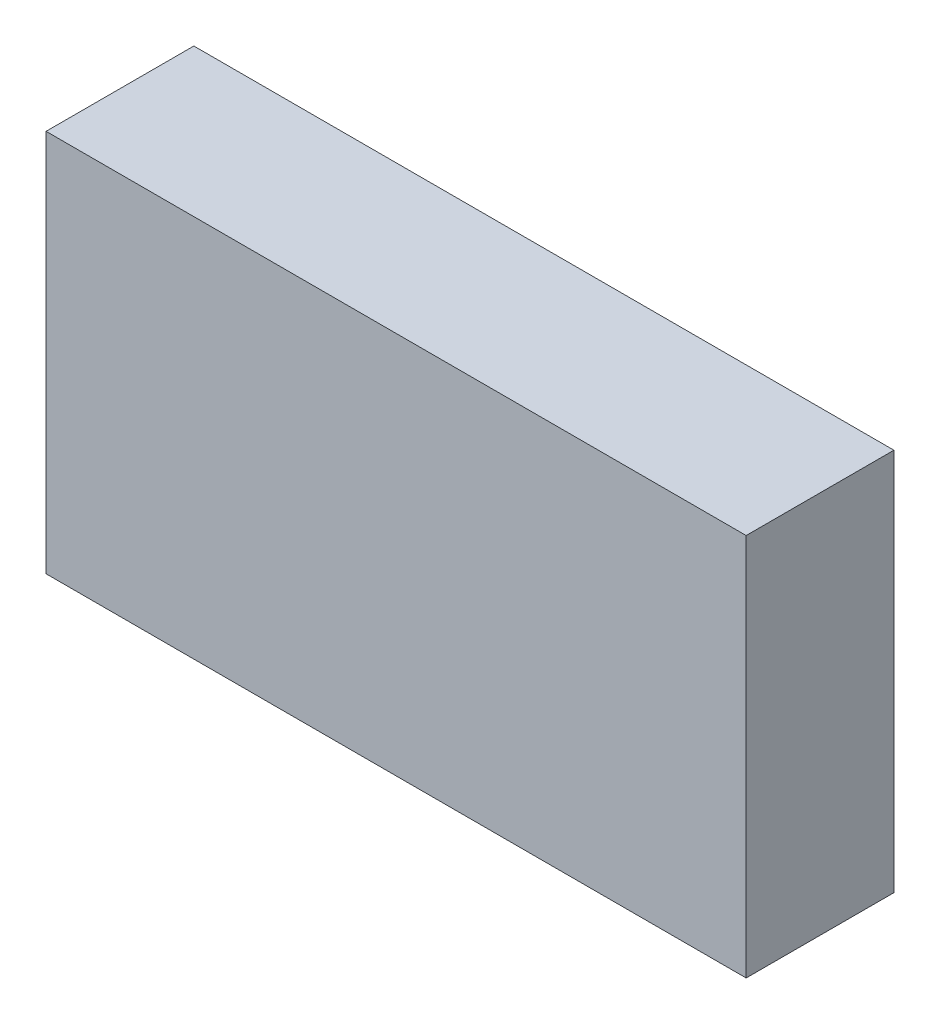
SolidWorks part; units mm, degrees
ref_plane "Front Plane" through (0, 0, 0) normal (0, 0, 1) x (1, 0, 0)
ref_plane "Top Plane" through (0, 0, 0) normal (0, 1, 0) x (1, 0, 0)
ref_plane "Right Plane" through (0, 0, 0) normal (1, 0, 0) x (0, 0, -1)
sketch "Sketch1" plane through (0, 0, 0) normal (0, 0, 1) x (1, 0, 0)
  line L0 (85.0124, -46.5334) -> (-85.0124, 46.5334) construction
  line L1 (-85.0124, 46.5334) -> (85.0124, 46.5334)
  line L2 (-85.0124, 46.5334) -> (-85.0124, -46.5334)
  line L3 (-85.0124, -46.5334) -> (85.0124, -46.5334)
  line L4 (85.0124, 46.5334) -> (85.0124, -46.5334)
extrude "Extrude1" add sketch "Sketch1" along normal blind 35.8868
ref_plane "Plane1" through (0, 0, -75) normal (0, 0, 1) x (1, 0, 0)
sketch "Sketch3" plane through (0, 0, -75) normal (0, 0, 1) x (1, 0, 0)
  line L1 (85.0124, 46.5334) -> (14.9505, 46.5334)
  line L2 (85.0124, 46.5334) -> (85.0124, 0)
  line L3 (85.0124, 0) -> (14.9505, 0)
  line L4 (14.9505, 46.5334) -> (14.9505, 0)
